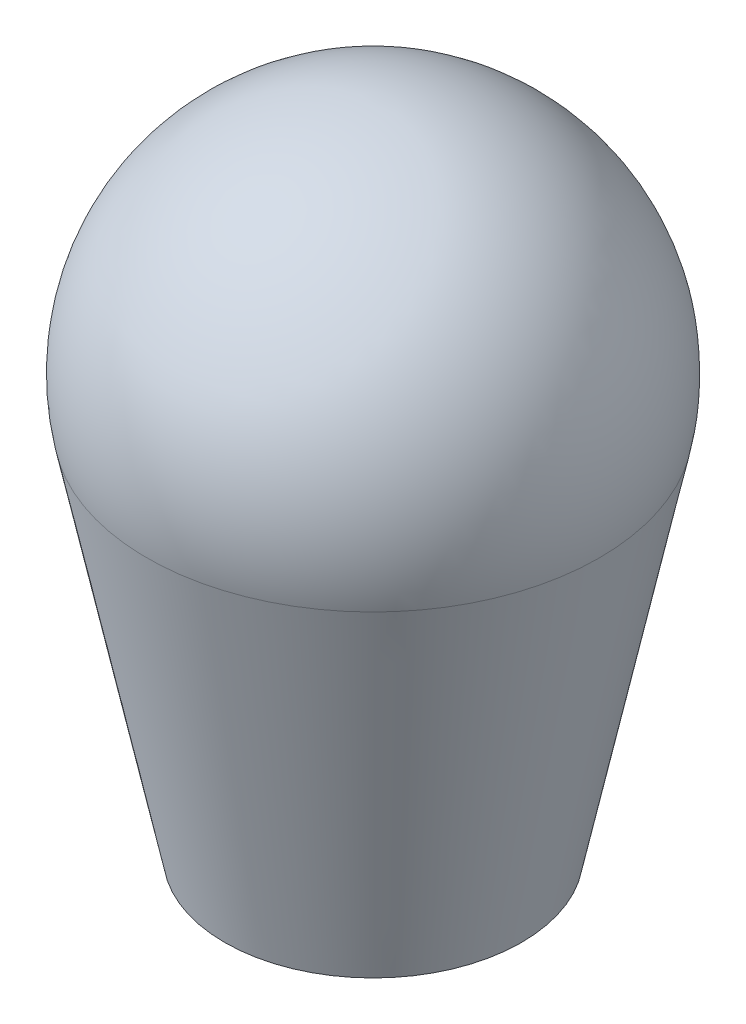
SolidWorks part; units mm, degrees
ref_plane "Přední" through (0, 0, 0) normal (0, 0, 1) x (1, 0, 0)
ref_plane "Horní" through (0, 0, 0) normal (0, 1, 0) x (1, 0, 0)
ref_plane "Pravá" through (0, 0, 0) normal (1, 0, 0) x (0, 0, -1)
sketch "Skica1" plane through (0, 0, 0) normal (0, 0, 1) x (1, 0, 0)
  line L0 (0, 0) -> (0, 264.5) construction
  line L1 (92, 151.2784) -> (60.375, 0)
  line L2 (60.375, 0) -> (0, 0)
  line L3 (0, 264.5) -> (-22.3209, 264.5) construction
  line L4 (0, 0) -> (0, 264.5)
  arc A0 (0, 264.5) -> (92, 151.2784) centre (0, 170.5112) cw
  dimension "D1" = 264.5
  dimension "D2" = 184
  dimension "D3" = 120.75
revolve "Otočit kolem osy1" add sketch "Skica1" angle 360 about L0
sketch "Skica4" plane through (0, 0, 0) normal (1, 0, 0) x (0, 0, -1)
  line L0 (-92, 151.2784) -> (-60.375, 0)
  line L1 (59.3962, 0.2046) -> (91.0212, 151.4831)
  line L2 (60.375, 0) -> (92, 151.2784)
  line L3 (60.375, 0) -> (92, 151.2784) construction
  line L4 (59.3962, 0.2046) -> (59.3534, 0)
  line L5 (-60.375, 0) -> (60.375, 0) construction
  dimension "D1" = 1
sketch "Skica5" plane through (0, 0, 0) normal (0, -1, 0) x (1, 0, 0)
  line L0 (0, -59.3534) -> (-47.0587, -37.8235)
  circle A0 centre (0, 0) radius 60.375 construction
  dimension "D1" = 51.75
ref_plane "Rovina2" through (-21.6715, -9.9024, -47.3683) normal (0.4087, 0.1868, 0.8933) x (0.9127, -0.0836, -0.4001)
other "Odebrat povrchem2"
mirror "Zrcadlit1" about plane through (0, 0, 0) normal (1, 0, 0) of "Odebrat povrchem2"
sketch "Skica7" plane through (0, 0, 0) normal (0, 0, 1) x (1, 0, 0)
  line L0 (-46, 0) -> (46, 0) construction
  line L1 (-60.375, 0) -> (60.375, 0) construction
  line L2 (0, 28.0421) -> (0, -23.7079) construction
  line L3 (0, 28.0421) -> (0, 0)
  line L4 (0, 0) -> (-46, 0)
  arc A0 (-46, 0) -> (0, 28.0421) centre (0, -23.7079) cw
  arc A1 (0, 28.0421) -> (46, 0) centre (0, -23.7079) cw construction
  dimension "D2" = 51.75
  dimension "D1" = 92
revolve "Odebrat otočením1" cut sketch "Skica7" angle 360 about L2
ref_plane "Plano1" through (38.0202, -17.3727, -83.1023) normal (0.4087, -0.1868, -0.8933) x (-0.9127, -0.0836, -0.4001)
sketch "Esboço1" plane through (38.0202, -17.3727, -83.1023) normal (0.4087, -0.1868, -0.8933) x (-0.9127, -0.0836, -0.4001)
  line L0 (13.4238, 163.1883) -> (-30.1557, 182.4146)
  line L2 (-30.1557, 182.4146) -> (-44.565, 149.7536)
  line L3 (-44.565, 149.7536) -> (13.4238, 149.7536)
  line L4 (13.4238, 149.7536) -> (13.4238, 163.1883)
wrap "Envolver1" sketch "Esboço1" wrap type emboss source sketch "Esboço1" thickness 3.048 parameters "D1"=3.048
mirror "Espelhar2" about plane through (0, 0, 0) normal (1, 0, 0) of "Envolver1"
